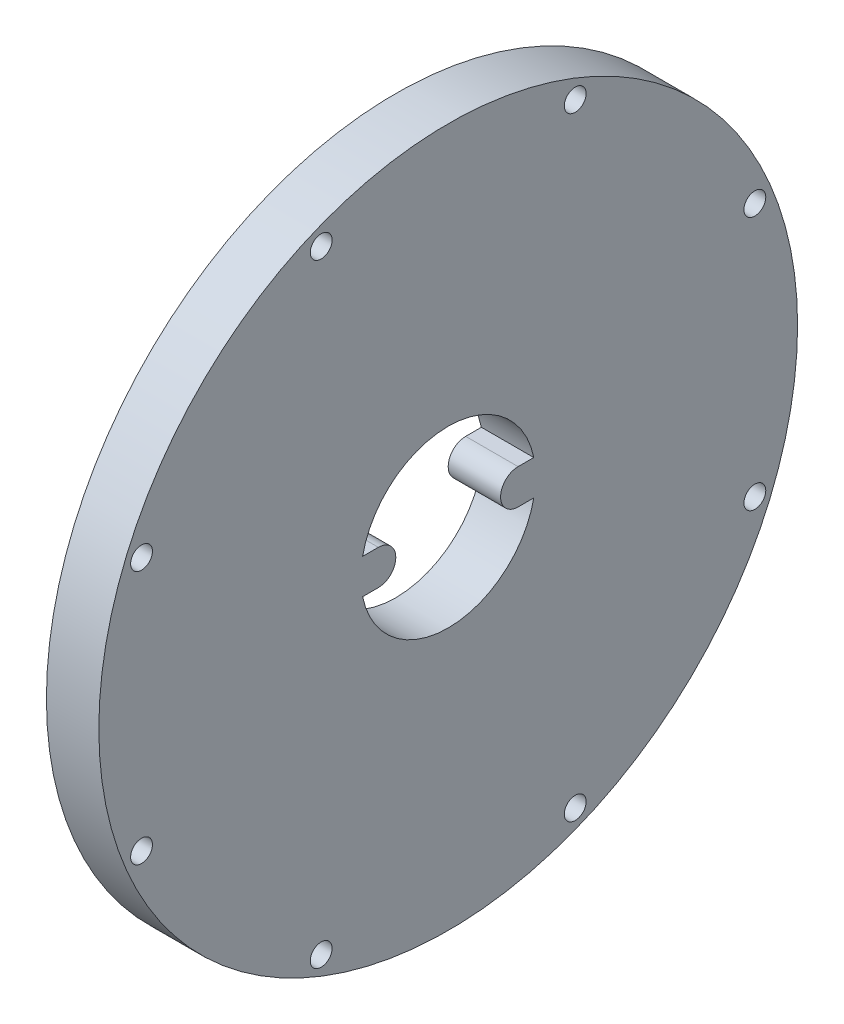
SolidWorks part; units mm, degrees
ref_plane "Plan de face" through (0, 0, 0) normal (0, 0, 1) x (1, 0, 0)
ref_plane "Plan de dessus" through (0, 0, 0) normal (0, 1, 0) x (1, 0, 0)
ref_plane "Plan de droite" through (0, 0, 0) normal (1, 0, 0) x (0, 0, -1)
sketch "Esquisse1" plane through (0, 0, 0) normal (1, 0, 0) x (0, 0, -1)
  line L0 (0, -44.3127) -> (0, 91.8426) construction
  line L1 (-29.1578, 0) -> (31.462, 0) construction
  line L2 (-29.1578, -4) -> (-6.8077, -4) construction
  line L3 (-29.1578, 4) -> (-6.8077, 4) construction
  line L4 (-12, 3.2168) -> (-12, -7.504) construction
  line L5 (-16, 2.2896) -> (-16, -7.504) construction
  line L6 (-16, 4) -> (-19.5959, 4)
  line L7 (-16, -4) -> (-19.5959, -4)
  line L8 (16, 4) -> (19.5959, 4)
  line L9 (16, -4) -> (19.5959, -4)
  circle A0 centre (0, 0) radius 80
  arc A1 (-19.5959, -4) -> (19.5959, -4) centre (0, 0) ccw
  arc A2 (-16, -4) -> (-16, 4) centre (-16, 0) ccw
  arc A3 (16, -4) -> (16, 4) centre (16, 0) cw
  arc A4 (19.5959, 4) -> (-19.5959, 4) centre (0, 0) ccw
  circle A5 centre (0, 0) radius 76 construction
  circle A7 centre (29.0839, 70.2148) radius 1.5
  circle A9 centre (70.2148, 29.0839) radius 1.5
  circle A11 centre (70.2148, -29.0839) radius 1.5
  circle A13 centre (29.0839, -70.2148) radius 1.5
  circle A15 centre (-29.0839, -70.2148) radius 1.5
  circle A17 centre (-70.2148, -29.0839) radius 1.5
  circle A19 centre (-70.2148, 29.0839) radius 1.5
  circle A21 centre (-29.0839, 70.2148) radius 1.5
  circle A22 centre (0, 76) radius 1.5
  circle A23 centre (53.7401, 53.7401) radius 1.5
  circle A24 centre (76, 0) radius 1.5
  circle A25 centre (53.7401, -53.7401) radius 1.5
  circle A26 centre (0, -76) radius 1.5
  circle A27 centre (-53.7401, -53.7401) radius 1.5
  circle A28 centre (-76, 0) radius 1.5
  circle A29 centre (-53.7401, 53.7401) radius 1.5
  dimension "D1" = 4
  dimension "D5" = 16
  dimension "D2" = 8
  dimension "D3" = 4
  dimension "D4" = 12
extrude "Boss.-Extru.1" add sketch "Esquisse1" along normal blind 12
sketch "Esquisse2" plane through (12, 0, 0) normal (1, 0, 0) x (0, 0, -1)
  circle A0 centre (0, 0) radius 76 construction
  circle A2 centre (29.0839, 70.2148) radius 2.5
  circle A4 centre (70.2148, 29.0839) radius 2.5
  circle A6 centre (70.2148, -29.0839) radius 2.5
  circle A8 centre (29.0839, -70.2148) radius 2.5
  circle A10 centre (-29.0839, -70.2148) radius 2.5
  circle A12 centre (-70.2148, -29.0839) radius 2.5
  circle A14 centre (-70.2148, 29.0839) radius 2.5
  circle A16 centre (-29.0839, 70.2148) radius 2.5
  circle A17 centre (0, 76) radius 2.5
  circle A18 centre (53.7401, 53.7401) radius 2.5
  circle A19 centre (76, 0) radius 2.5
  circle A20 centre (53.7401, -53.7401) radius 2.5
  circle A21 centre (0, -76) radius 2.5
  circle A22 centre (-53.7401, -53.7401) radius 2.5
  circle A23 centre (-76, 0) radius 2.5
  circle A24 centre (-53.7401, 53.7401) radius 2.5
  dimension "D1" = 16
extrude "Enlèv. mat.-Extru.1" cut sketch "Esquisse2" against normal blind 5
